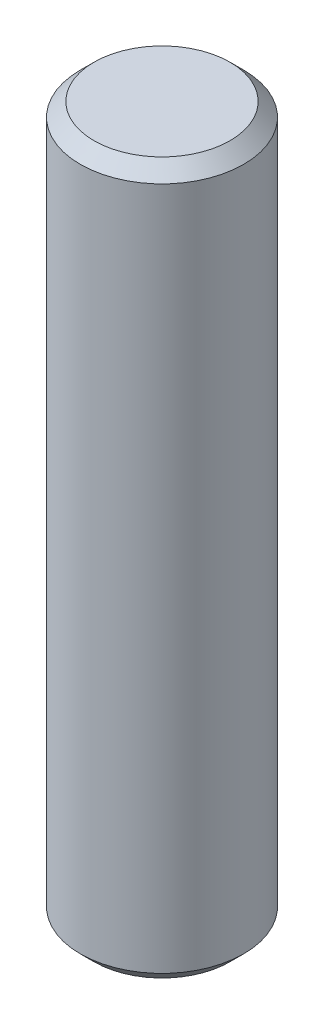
SolidWorks part; units mm, degrees
ref_plane "Front Plane" through (0, 0, 0) normal (0, 0, 1) x (1, 0, 0)
ref_plane "Top Plane" through (0, 0, 0) normal (0, 1, 0) x (1, 0, 0)
ref_plane "Right Plane" through (0, 0, 0) normal (1, 0, 0) x (0, 0, -1)
sketch "Sketch1" plane through (0, 0, 0) normal (0, 1, 0) x (1, 0, 0)
  circle A0 centre (0, 0) radius 2.987
  dimension "D1" = 5.974
extrude "M6 th'd rod" add sketch "Sketch1" along normal blind 26 contours A0
chamfer "Chamfer1" distance 0.5 angle 45 2 edges at (0, 0, 2.987) (0, 26, 2.987)
